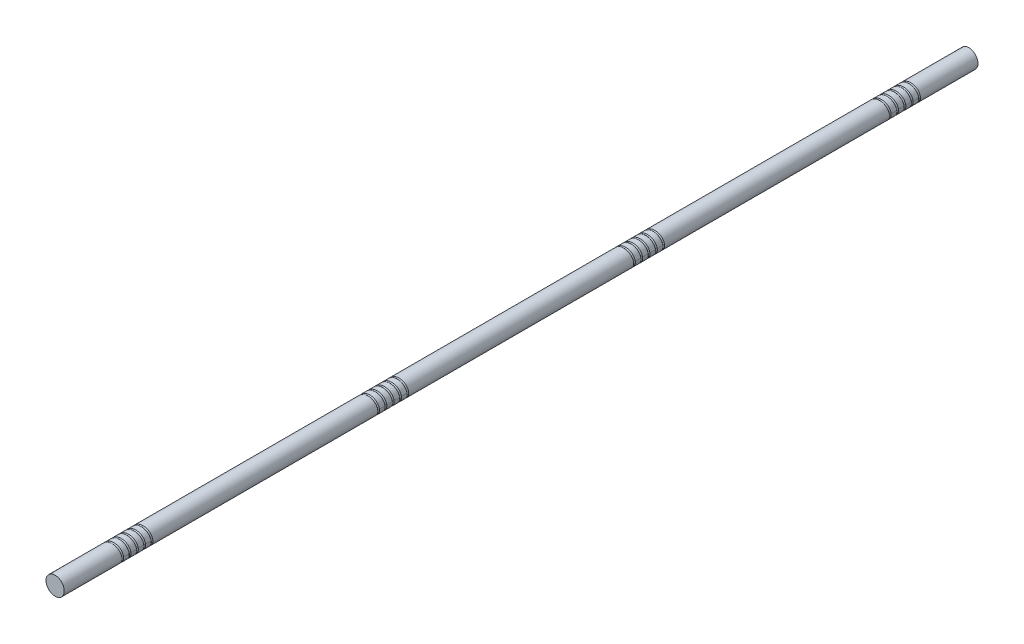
SolidWorks part; units mm, degrees
ref_plane "Front Plane" through (0, 0, 0) normal (0, 0, 1) x (1, 0, 0)
ref_plane "Top Plane" through (0, 0, 0) normal (0, 1, 0) x (1, 0, 0)
ref_plane "Right Plane" through (0, 0, 0) normal (1, 0, 0) x (0, 0, -1)
sketch "Sketch1" plane through (0, 0, 0) normal (0, 0, 1) x (1, 0, 0)
  circle A0 centre (0, 0) radius 25
  dimension "D1" = 50
extrude "Boss-Extrude1" add sketch "Sketch1" along normal blind 2500
ref_plane "Plane1" through (0, 0, 150) normal (0, 0, 1) x (1, 0, 0)
sketch "Sketch2" plane through (0, 0, 150) normal (0, 0, 1) x (1, 0, 0)
  circle A0 centre (0, 0) radius 27.1167
  dimension "D1" = 54.2333
curve "Helix/Spiral1"
sketch "Sketch3" plane through (0, 0, 0) normal (0, 1, 0) x (1, 0, 0)
  circle A0 centre (-27.1167, -150) radius 3.175
  spline S0 degree 3 number of poles 118 (-27.1167, -150) -> (-27.1167, -250) construction
  dimension "D1" = 6.35
sweep "Cut-Sweep1" cut profiles "Sketch3" path "Helix/Spiral1"
pattern_linear "LPattern1" count 4 spacing 700 along (0, 0, -1) of "Cut-Sweep1"
